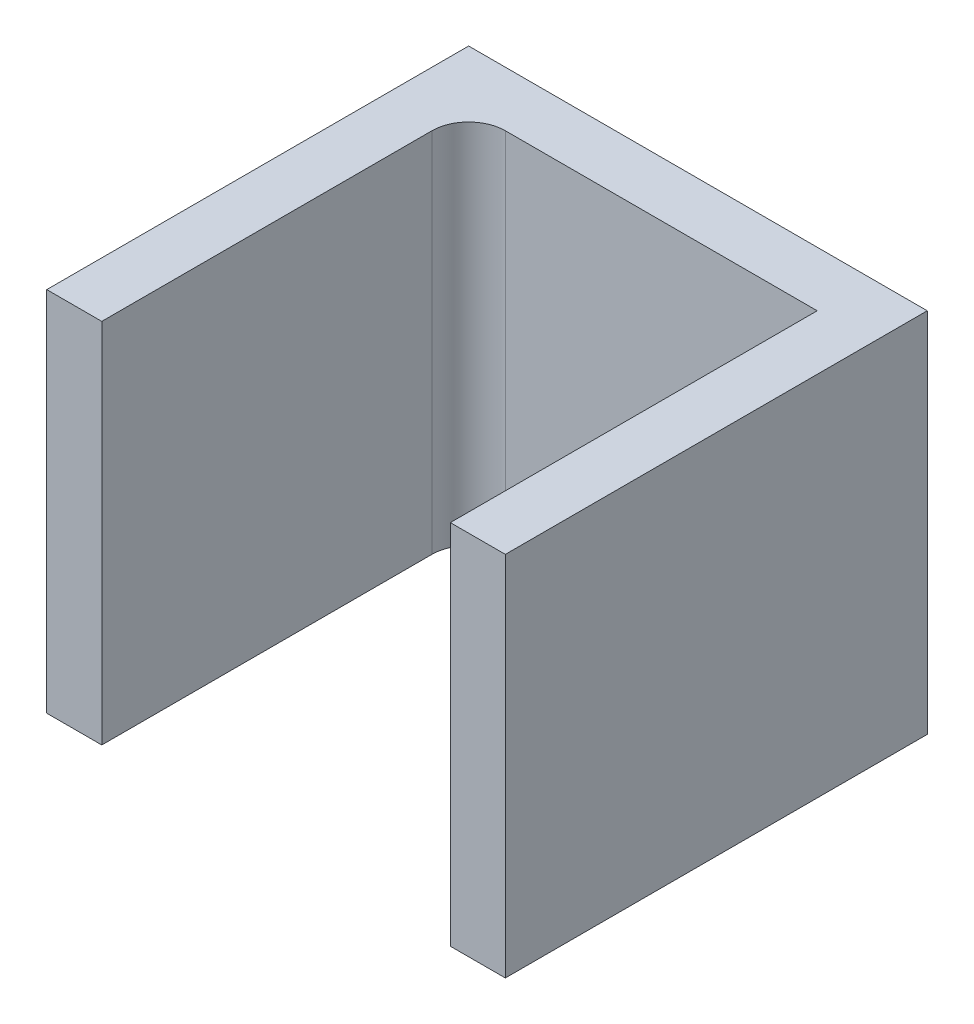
SolidWorks part; units mm, degrees
ref_plane "Plan de face" through (0, 0, 0) normal (0, 0, 1) x (1, 0, 0)
ref_plane "Plan de dessus" through (0, 0, 0) normal (0, 1, 0) x (1, 0, 0)
ref_plane "Plan de droite" through (0, 0, 0) normal (1, 0, 0) x (0, 0, -1)
sketch "Esquisse1" plane through (0, 0, 0) normal (0, 1, 0) x (1, 0, 0)
  line L0 (-5.7087, 0) -> (-5.7087, 20)
  line L1 (-5.7087, 20) -> (13.2913, 20)
  line L2 (13.2913, 20) -> (13.2913, 0)
  line L3 (13.2913, 0) -> (16.2913, 0)
  line L4 (16.2913, 0) -> (16.2913, 23)
  line L5 (16.2913, 23) -> (-8.7087, 23)
  line L6 (-8.7087, 23) -> (-8.7087, 0)
  line L7 (-8.7087, 0) -> (-5.7087, 0)
  dimension "D1" = 19
  dimension "D2" = 3
  dimension "D3" = 3
  dimension "D4" = 20
extrude "Boss.-Extru.1" add sketch "Esquisse1" along normal blind 20
fillet "Congé1" radius 2 1 edges at (-5.7087, 10, -20)
